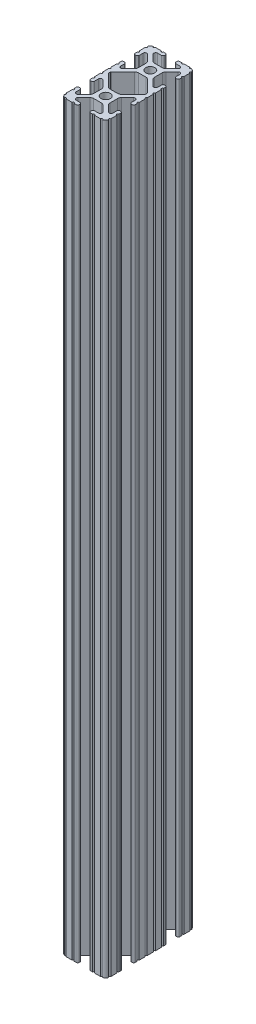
SolidWorks part; units mm, degrees
ref_plane "Front Plane" through (0, 0, 0) normal (0, 0, 1) x (1, 0, 0)
ref_plane "Top Plane" through (0, 0, 0) normal (0, 1, 0) x (1, 0, 0)
ref_plane "Right Plane" through (0, 0, 0) normal (1, 0, 0) x (0, 0, -1)
sketch "Length Definition" plane through (0, 0, 0) normal (0, 0, 1) x (1, 0, 0)
  line L0 (13.97, 0) -> (-13.97, 0) construction
  line L1 (-25.4, 0) -> (25.4, 0) construction
  line L2 (-25.4, 0) -> (-25.4, 268.013) construction
  line L3 (-25.4, 268.013) -> (25.4, 268.013)
  line L4 (25.4, 0) -> (25.4, 268.013) construction
  line L5 (-23.0571, 268.013) -> (-791.1725, 268.013) construction
  point P8 (0, 0)
  dimension "D1" = 50.8
sketch "Upper Arm Sketch" plane through (0, 0, 0) normal (0, 0, 1) x (1, 0, 0)
  line L1 (12.7, 372.2042) -> (280.713, 372.2042) construction
  line L2 (-25.4, 0) -> (25.4, 0) construction
  line L3 (-25.4, 0) -> (-25.4, 423.0042) construction
  line L4 (25.4, 0) -> (25.4, 423.0042) construction
  line L5 (-25.4, 0) -> (25.4, 0) construction
  line L6 (-25.4, 0) -> (-25.4, 268.013) construction
  line L7 (25.4, 0) -> (25.4, 268.013) construction
  line L8 (-25.4, 423.0042) -> (25.4, 423.0042)
  line L9 (0, 423.0042) -> (0, 0)
  dimension "D1" = 50.8
ref_plane "Extrusion End" [suppressed] through (0, 268.013, 0) normal (0, 1, 0) x (1, 0, 0)
sketch "Extrusion profile" [suppressed] plane through (0, 0, 0) normal (0, 0, 1) x (1, 0, 0)
  line L0 (0, 0) -> (0, 268.013)
  line L1 (27.94, 268.013) -> (-27.94, 268.013) construction
  line L2 (-25.4, 268.013) -> (25.4, 268.013) construction
other "Al extrusions 2X1 T-SLOT 1020(1)"
ref_plane "Plane2" through (0, 0, 0) normal (0, 1, 0) x (-1, 0, 0)
sketch "Sketch4" plane through (0, 0, 0) normal (0, 1, 0) x (-1, 0, 0)
  line L0 (0, -25.4) -> (0, 25.4) construction
  line L1 (-12.7, 25.4) -> (12.7, 25.4) construction
  line L2 (-12.7, 25.4) -> (-12.7, -25.4) construction
  line L3 (-12.7, -25.4) -> (12.7, -25.4) construction
  line L4 (12.7, 25.4) -> (12.7, -25.4) construction
  line L5 (12.7, 0) -> (-12.7, 0) construction
  line L6 (-12.7, 25.4) -> (12.7, 0) construction
  line L7 (-12.7, 0) -> (12.7, 25.4) construction
  line L8 (-12.7, 0) -> (12.7, -25.4) construction
  line L9 (12.7, 0) -> (-12.7, -25.4) construction
  line L16 (-2.164, -8.0518) -> (2.164, -8.0518)
  line L17 (-10.3284, -0.809) -> (-3.7373, -7.4001)
  line L18 (-10.4902, 0.4184) -> (-10.4902, -0.4184)
  line L19 (-3.7373, 7.4001) -> (-10.3284, 0.809)
  line L20 (2.164, 8.0518) -> (-2.164, 8.0518)
  line L21 (10.3284, 0.809) -> (3.7373, 7.4001)
  line L22 (10.4902, -0.4184) -> (10.4902, 0.4184)
  line L23 (3.7373, -7.4001) -> (10.3284, -0.809)
  line L152 (-2.164, -17.3482) -> (2.164, -17.3482)
  line L153 (3.7373, -17.9999) -> (7.1039, -21.3665)
  line L154 (6.3485, -23.1902) -> (4.1904, -23.1902)
  line L155 (3.2512, -24.1294) -> (3.2512, -24.4608)
  line L156 (4.1904, -25.4) -> (5.2436, -25.4)
  line L157 (6.3485, -25.4) -> (9.8037, -25.4)
  line L158 (12.7, -22.5037) -> (12.7, -19.0485)
  line L159 (12.7, -17.9436) -> (12.7, -16.8904)
  line L160 (11.7608, -15.9512) -> (11.4294, -15.9512)
  line L161 (10.4902, -16.8904) -> (10.4902, -19.0485)
  line L162 (8.6665, -19.8039) -> (5.2999, -16.4373)
  line L163 (4.6482, -14.864) -> (4.6482, -10.536)
  line L164 (5.2999, -8.9627) -> (8.6665, -5.5961)
  line L165 (10.4902, -6.3515) -> (10.4902, -8.5096)
  line L166 (11.4294, -9.4488) -> (11.7608, -9.4488)
  line L167 (12.7, -8.5096) -> (12.7, -7.4564)
  line L168 (12.7, -6.3515) -> (12.7, -2.8963)
  line L169 (12.7, -1.7914) -> (12.7, 1.7914)
  line L170 (12.7, 2.8963) -> (12.7, 6.3515)
  line L171 (12.7, 7.4564) -> (12.7, 8.5096)
  line L172 (11.7608, 9.4488) -> (11.4294, 9.4488)
  line L173 (10.4902, 8.5096) -> (10.4902, 6.3515)
  line L174 (8.6665, 5.5961) -> (5.2999, 8.9627)
  line L175 (4.6482, 10.536) -> (4.6482, 14.864)
  line L176 (5.2999, 16.4373) -> (8.6665, 19.8039)
  line L177 (10.4902, 19.0485) -> (10.4902, 16.8904)
  line L178 (11.4294, 15.9512) -> (11.7608, 15.9512)
  line L179 (12.7, 16.8904) -> (12.7, 17.9436)
  line L180 (12.7, 19.0485) -> (12.7, 22.5037)
  line L181 (9.8037, 25.4) -> (6.3485, 25.4)
  line L182 (5.2436, 25.4) -> (4.1904, 25.4)
  line L183 (3.2512, 24.4608) -> (3.2512, 24.1294)
  line L184 (4.1904, 23.1902) -> (6.3485, 23.1902)
  line L185 (7.1039, 21.3665) -> (3.7373, 17.9999)
  line L186 (2.164, 17.3482) -> (-2.164, 17.3482)
  line L187 (-3.7373, 17.9999) -> (-7.1039, 21.3665)
  line L188 (-6.3485, 23.1902) -> (-4.1904, 23.1902)
  line L189 (-3.2512, 24.1294) -> (-3.2512, 24.4608)
  line L190 (-4.1904, 25.4) -> (-5.2436, 25.4)
  line L191 (-6.3485, 25.4) -> (-9.8037, 25.4)
  line L192 (-12.7, 22.5037) -> (-12.7, 19.0485)
  line L193 (-12.7, 17.9436) -> (-12.7, 16.8904)
  line L194 (-11.7608, 15.9512) -> (-11.4294, 15.9512)
  line L195 (-10.4902, 16.8904) -> (-10.4902, 19.0485)
  line L196 (-8.6665, 19.8039) -> (-5.2999, 16.4373)
  line L197 (-4.6482, 14.864) -> (-4.6482, 10.536)
  line L198 (-5.2999, 8.9627) -> (-8.6665, 5.5961)
  line L199 (-10.4902, 6.3515) -> (-10.4902, 8.5096)
  line L200 (-11.4294, 9.4488) -> (-11.7608, 9.4488)
  line L201 (-12.7, 8.5096) -> (-12.7, 7.4564)
  line L202 (-12.7, 6.3515) -> (-12.7, 2.8963)
  line L203 (-12.7, 1.7914) -> (-12.7, -1.7914)
  line L204 (-12.7, -2.8963) -> (-12.7, -6.3515)
  line L205 (-12.7, -7.4564) -> (-12.7, -8.5096)
  line L206 (-11.7608, -9.4488) -> (-11.4294, -9.4488)
  line L207 (-10.4902, -8.5096) -> (-10.4902, -6.3515)
  line L208 (-8.6665, -5.5961) -> (-5.2999, -8.9627)
  line L209 (-4.6482, -10.536) -> (-4.6482, -14.864)
  line L210 (-5.2999, -16.4373) -> (-8.6665, -19.8039)
  line L211 (-10.4902, -19.0485) -> (-10.4902, -16.8904)
  line L212 (-11.4294, -15.9512) -> (-11.7608, -15.9512)
  line L213 (-12.7, -16.8904) -> (-12.7, -17.9436)
  line L214 (-12.7, -19.0485) -> (-12.7, -22.5037)
  line L215 (-9.8037, -25.4) -> (-6.3485, -25.4)
  line L216 (-5.2436, -25.4) -> (-4.1904, -25.4)
  line L217 (-3.2512, -24.4608) -> (-3.2512, -24.1294)
  line L218 (-4.1904, -23.1902) -> (-6.3485, -23.1902)
  line L219 (-7.1039, -21.3665) -> (-3.7373, -17.9999)
  circle A2 centre (0, -12.7) radius 2.6035
  circle A4 centre (0, 12.7) radius 2.6035
  arc A16 (-3.7373, -7.4001) -> (-2.164, -8.0518) centre (-2.164, -5.8268) ccw
  arc A17 (-10.4902, -0.4184) -> (-10.3284, -0.809) centre (-9.9377, -0.4184) ccw
  arc A18 (-10.3284, 0.809) -> (-10.4902, 0.4184) centre (-9.9377, 0.4184) ccw
  arc A19 (-2.164, 8.0518) -> (-3.7373, 7.4001) centre (-2.164, 5.8268) ccw
  arc A20 (3.7373, 7.4001) -> (2.164, 8.0518) centre (2.164, 5.8268) ccw
  arc A21 (10.4902, 0.4184) -> (10.3284, 0.809) centre (9.9378, 0.4184) ccw
  arc A22 (10.3284, -0.809) -> (10.4902, -0.4184) centre (9.9378, -0.4184) ccw
  arc A23 (2.164, -8.0518) -> (3.7373, -7.4001) centre (2.164, -5.8268) ccw
  arc A172 (-2.164, -17.3482) -> (-3.7373, -17.9999) centre (-2.164, -19.5732) ccw
  arc A173 (3.7373, -17.9999) -> (2.164, -17.3482) centre (2.164, -19.5732) ccw
  arc A174 (6.3485, -23.1902) -> (7.1039, -21.3665) centre (6.3485, -22.1219) ccw
  arc A175 (4.1904, -23.1902) -> (3.2512, -24.1294) centre (4.1904, -24.1294) ccw
  arc A176 (3.2512, -24.4608) -> (4.1904, -25.4) centre (4.1904, -24.4608) ccw
  arc A177 (6.3485, -25.4) -> (5.2436, -25.4) centre (5.796, -25.4) ccw
  arc A178 (10.8954, -25.28) -> (9.8037, -25.4) centre (10.3562, -25.4) ccw
  arc A179 (10.8954, -25.28) -> (12.58, -23.5954) centre (10.1173, -22.8173) ccw
  arc A180 (12.7, -22.5037) -> (12.58, -23.5954) centre (12.7, -23.0562) ccw
  arc A181 (12.7, -17.9436) -> (12.7, -19.0485) centre (12.7, -18.496) ccw
  arc A182 (12.7, -16.8904) -> (11.7608, -15.9512) centre (11.7608, -16.8904) ccw
  arc A183 (11.4294, -15.9512) -> (10.4902, -16.8904) centre (11.4294, -16.8904) ccw
  arc A184 (8.6665, -19.8039) -> (10.4902, -19.0485) centre (9.4219, -19.0485) ccw
  arc A185 (4.6482, -14.864) -> (5.2999, -16.4373) centre (6.8732, -14.864) ccw
  arc A186 (5.2999, -8.9627) -> (4.6482, -10.536) centre (6.8732, -10.536) ccw
  arc A187 (10.4902, -6.3515) -> (8.6665, -5.5961) centre (9.4219, -6.3515) ccw
  arc A188 (10.4902, -8.5096) -> (11.4294, -9.4488) centre (11.4294, -8.5096) ccw
  arc A189 (11.7608, -9.4488) -> (12.7, -8.5096) centre (11.7608, -8.5096) ccw
  arc A190 (12.7, -6.3515) -> (12.7, -7.4564) centre (12.7, -6.904) ccw
  arc A191 (12.7, -1.7914) -> (12.7, -2.8963) centre (12.7, -2.3438) ccw
  arc A192 (12.7, 2.8963) -> (12.7, 1.7914) centre (12.7, 2.3438) ccw
  arc A193 (12.7, 7.4564) -> (12.7, 6.3515) centre (12.7, 6.904) ccw
  arc A194 (12.7, 8.5096) -> (11.7608, 9.4488) centre (11.7608, 8.5096) ccw
  arc A195 (11.4294, 9.4488) -> (10.4902, 8.5096) centre (11.4294, 8.5096) ccw
  arc A196 (8.6665, 5.5961) -> (10.4902, 6.3515) centre (9.4219, 6.3515) ccw
  arc A197 (4.6482, 10.536) -> (5.2999, 8.9627) centre (6.8732, 10.536) ccw
  arc A198 (5.2999, 16.4373) -> (4.6482, 14.864) centre (6.8732, 14.864) ccw
  arc A199 (10.4902, 19.0485) -> (8.6665, 19.8039) centre (9.4219, 19.0485) ccw
  arc A200 (10.4902, 16.8904) -> (11.4294, 15.9512) centre (11.4294, 16.8904) ccw
  arc A201 (11.7608, 15.9512) -> (12.7, 16.8904) centre (11.7608, 16.8904) ccw
  arc A202 (12.7, 19.0485) -> (12.7, 17.9436) centre (12.7, 18.496) ccw
  arc A203 (12.58, 23.5954) -> (12.7, 22.5037) centre (12.7, 23.0562) ccw
  arc A204 (12.58, 23.5954) -> (10.8954, 25.28) centre (10.1173, 22.8173) ccw
  arc A205 (9.8037, 25.4) -> (10.8954, 25.28) centre (10.3562, 25.4) ccw
  arc A206 (5.2436, 25.4) -> (6.3485, 25.4) centre (5.796, 25.4) ccw
  arc A207 (4.1904, 25.4) -> (3.2512, 24.4608) centre (4.1904, 24.4608) ccw
  arc A208 (3.2512, 24.1294) -> (4.1904, 23.1902) centre (4.1904, 24.1294) ccw
  arc A209 (7.1039, 21.3665) -> (6.3485, 23.1902) centre (6.3485, 22.1219) ccw
  arc A210 (2.164, 17.3482) -> (3.7373, 17.9999) centre (2.164, 19.5732) ccw
  arc A211 (-3.7373, 17.9999) -> (-2.164, 17.3482) centre (-2.164, 19.5732) ccw
  arc A212 (-6.3485, 23.1902) -> (-7.1039, 21.3665) centre (-6.3485, 22.1219) ccw
  arc A213 (-4.1904, 23.1902) -> (-3.2512, 24.1294) centre (-4.1904, 24.1294) ccw
  arc A214 (-3.2512, 24.4608) -> (-4.1904, 25.4) centre (-4.1904, 24.4608) ccw
  arc A215 (-6.3485, 25.4) -> (-5.2436, 25.4) centre (-5.796, 25.4) ccw
  arc A216 (-10.8954, 25.28) -> (-9.8037, 25.4) centre (-10.3562, 25.4) ccw
  arc A217 (-10.8954, 25.28) -> (-12.58, 23.5954) centre (-10.1173, 22.8173) ccw
  arc A218 (-12.7, 22.5037) -> (-12.58, 23.5954) centre (-12.7, 23.0562) ccw
  arc A219 (-12.7, 17.9436) -> (-12.7, 19.0485) centre (-12.7, 18.496) ccw
  arc A220 (-12.7, 16.8904) -> (-11.7608, 15.9512) centre (-11.7608, 16.8904) ccw
  arc A221 (-11.4294, 15.9512) -> (-10.4902, 16.8904) centre (-11.4294, 16.8904) ccw
  arc A222 (-8.6665, 19.8039) -> (-10.4902, 19.0485) centre (-9.4219, 19.0485) ccw
  arc A223 (-4.6482, 14.864) -> (-5.2999, 16.4373) centre (-6.8732, 14.864) ccw
  arc A224 (-5.2999, 8.9627) -> (-4.6482, 10.536) centre (-6.8732, 10.536) ccw
  arc A225 (-10.4902, 6.3515) -> (-8.6665, 5.5961) centre (-9.4219, 6.3515) ccw
  arc A226 (-10.4902, 8.5096) -> (-11.4294, 9.4488) centre (-11.4294, 8.5096) ccw
  arc A227 (-11.7608, 9.4488) -> (-12.7, 8.5096) centre (-11.7608, 8.5096) ccw
  arc A228 (-12.7, 6.3515) -> (-12.7, 7.4564) centre (-12.7, 6.904) ccw
  arc A229 (-12.7, 1.7914) -> (-12.7, 2.8963) centre (-12.7, 2.3438) ccw
  arc A230 (-12.7, -2.8963) -> (-12.7, -1.7914) centre (-12.7, -2.3438) ccw
  arc A231 (-12.7, -7.4564) -> (-12.7, -6.3515) centre (-12.7, -6.904) ccw
  arc A232 (-12.7, -8.5096) -> (-11.7608, -9.4488) centre (-11.7608, -8.5096) ccw
  arc A233 (-11.4294, -9.4488) -> (-10.4902, -8.5096) centre (-11.4294, -8.5096) ccw
  arc A234 (-8.6665, -5.5961) -> (-10.4902, -6.3515) centre (-9.4219, -6.3515) ccw
  arc A235 (-4.6482, -10.536) -> (-5.2999, -8.9627) centre (-6.8732, -10.536) ccw
  arc A236 (-5.2999, -16.4373) -> (-4.6482, -14.864) centre (-6.8732, -14.864) ccw
  arc A237 (-10.4902, -19.0485) -> (-8.6665, -19.8039) centre (-9.4219, -19.0485) ccw
  arc A238 (-10.4902, -16.8904) -> (-11.4294, -15.9512) centre (-11.4294, -16.8904) ccw
  arc A239 (-11.7608, -15.9512) -> (-12.7, -16.8904) centre (-11.7608, -16.8904) ccw
  arc A240 (-12.7, -19.0485) -> (-12.7, -17.9436) centre (-12.7, -18.496) ccw
  arc A241 (-12.58, -23.5954) -> (-12.7, -22.5037) centre (-12.7, -23.0562) ccw
  arc A242 (-12.58, -23.5954) -> (-10.8954, -25.28) centre (-10.1173, -22.8173) ccw
  arc A243 (-9.8037, -25.4) -> (-10.8954, -25.28) centre (-10.3562, -25.4) ccw
  arc A244 (-5.2436, -25.4) -> (-6.3485, -25.4) centre (-5.796, -25.4) ccw
  arc A245 (-4.1904, -25.4) -> (-3.2512, -24.4608) centre (-4.1904, -24.4608) ccw
  arc A246 (-3.2512, -24.1294) -> (-4.1904, -23.1902) centre (-4.1904, -24.1294) ccw
  arc A247 (-7.1039, -21.3665) -> (-6.3485, -23.1902) centre (-6.3485, -22.1219) ccw
  point P45 (0, 25.4)
  point P50 (0, -25.4)
  point P60 (-12.7, 0)
  point P71 (0, 0)
  point P76 (0, 8.0518)
  point P81 (-10.4902, 0)
  point P86 (0, 0)
  dimension "D4" = 5.207
  dimension "D1" = 25.4
  dimension "D2" = 50.8
  dimension "D3" = 25.4
  dimension "D5" = 6.5024
  dimension "D6" = 12.7
  dimension "D7" = 2.2098
  dimension "D8" = 1.1049
  dimension "D9" = 2.164
  dimension "D10" = 0.4184
  dimension "D11" = 5.8268
  dimension "D12" = 9.9377
  dimension "D13" = 135
  dimension "D14" = 45
  dimension "D15" = 8.0518
  dimension "D16" = 10.4902
  dimension "D17" = 8.0518
  dimension "D18" = 10.4902
other "Al extrusions 2X1 T-SLOT 1020(2)"
ref_plane "Plane3" through (0, 423.0042, 0) normal (0, -1, 0) x (1, 0, 0)
sketch "Sketch41" plane through (0, 423.0042, 0) normal (0, -1, 0) x (1, 0, 0)
  line L0 (0, -25.4) -> (0, 25.4) construction
  line L1 (-12.7, 25.4) -> (12.7, 25.4) construction
  line L2 (-12.7, 25.4) -> (-12.7, -25.4) construction
  line L3 (-12.7, -25.4) -> (12.7, -25.4) construction
  line L4 (12.7, 25.4) -> (12.7, -25.4) construction
  line L5 (12.7, 0) -> (-12.7, 0) construction
  line L6 (-12.7, 25.4) -> (12.7, 0) construction
  line L7 (-12.7, 0) -> (12.7, 25.4) construction
  line L8 (-12.7, 0) -> (12.7, -25.4) construction
  line L9 (12.7, 0) -> (-12.7, -25.4) construction
  line L16 (-2.164, -8.0518) -> (2.164, -8.0518)
  line L17 (-10.3284, -0.809) -> (-3.7373, -7.4001)
  line L18 (-10.4902, 0.4184) -> (-10.4902, -0.4184)
  line L19 (-3.7373, 7.4001) -> (-10.3284, 0.809)
  line L20 (2.164, 8.0518) -> (-2.164, 8.0518)
  line L21 (10.3284, 0.809) -> (3.7373, 7.4001)
  line L22 (10.4902, -0.4184) -> (10.4902, 0.4184)
  line L23 (3.7373, -7.4001) -> (10.3284, -0.809)
  line L152 (-2.164, -17.3482) -> (2.164, -17.3482)
  line L153 (3.7373, -17.9999) -> (7.1039, -21.3665)
  line L154 (6.3485, -23.1902) -> (4.1904, -23.1902)
  line L155 (3.2512, -24.1294) -> (3.2512, -24.4608)
  line L156 (4.1904, -25.4) -> (5.2436, -25.4)
  line L157 (6.3485, -25.4) -> (9.8037, -25.4)
  line L158 (12.7, -22.5037) -> (12.7, -19.0485)
  line L159 (12.7, -17.9436) -> (12.7, -16.8904)
  line L160 (11.7608, -15.9512) -> (11.4294, -15.9512)
  line L161 (10.4902, -16.8904) -> (10.4902, -19.0485)
  line L162 (8.6665, -19.8039) -> (5.2999, -16.4373)
  line L163 (4.6482, -14.864) -> (4.6482, -10.536)
  line L164 (5.2999, -8.9627) -> (8.6665, -5.5961)
  line L165 (10.4902, -6.3515) -> (10.4902, -8.5096)
  line L166 (11.4294, -9.4488) -> (11.7608, -9.4488)
  line L167 (12.7, -8.5096) -> (12.7, -7.4564)
  line L168 (12.7, -6.3515) -> (12.7, -2.8963)
  line L169 (12.7, -1.7914) -> (12.7, 1.7914)
  line L170 (12.7, 2.8963) -> (12.7, 6.3515)
  line L171 (12.7, 7.4564) -> (12.7, 8.5096)
  line L172 (11.7608, 9.4488) -> (11.4294, 9.4488)
  line L173 (10.4902, 8.5096) -> (10.4902, 6.3515)
  line L174 (8.6665, 5.5961) -> (5.2999, 8.9627)
  line L175 (4.6482, 10.536) -> (4.6482, 14.864)
  line L176 (5.2999, 16.4373) -> (8.6665, 19.8039)
  line L177 (10.4902, 19.0485) -> (10.4902, 16.8904)
  line L178 (11.4294, 15.9512) -> (11.7608, 15.9512)
  line L179 (12.7, 16.8904) -> (12.7, 17.9436)
  line L180 (12.7, 19.0485) -> (12.7, 22.5037)
  line L181 (9.8037, 25.4) -> (6.3485, 25.4)
  line L182 (5.2436, 25.4) -> (4.1904, 25.4)
  line L183 (3.2512, 24.4608) -> (3.2512, 24.1294)
  line L184 (4.1904, 23.1902) -> (6.3485, 23.1902)
  line L185 (7.1039, 21.3665) -> (3.7373, 17.9999)
  line L186 (2.164, 17.3482) -> (-2.164, 17.3482)
  line L187 (-3.7373, 17.9999) -> (-7.1039, 21.3665)
  line L188 (-6.3485, 23.1902) -> (-4.1904, 23.1902)
  line L189 (-3.2512, 24.1294) -> (-3.2512, 24.4608)
  line L190 (-4.1904, 25.4) -> (-5.2436, 25.4)
  line L191 (-6.3485, 25.4) -> (-9.8037, 25.4)
  line L192 (-12.7, 22.5037) -> (-12.7, 19.0485)
  line L193 (-12.7, 17.9436) -> (-12.7, 16.8904)
  line L194 (-11.7608, 15.9512) -> (-11.4294, 15.9512)
  line L195 (-10.4902, 16.8904) -> (-10.4902, 19.0485)
  line L196 (-8.6665, 19.8039) -> (-5.2999, 16.4373)
  line L197 (-4.6482, 14.864) -> (-4.6482, 10.536)
  line L198 (-5.2999, 8.9627) -> (-8.6665, 5.5961)
  line L199 (-10.4902, 6.3515) -> (-10.4902, 8.5096)
  line L200 (-11.4294, 9.4488) -> (-11.7608, 9.4488)
  line L201 (-12.7, 8.5096) -> (-12.7, 7.4564)
  line L202 (-12.7, 6.3515) -> (-12.7, 2.8963)
  line L203 (-12.7, 1.7914) -> (-12.7, -1.7914)
  line L204 (-12.7, -2.8963) -> (-12.7, -6.3515)
  line L205 (-12.7, -7.4564) -> (-12.7, -8.5096)
  line L206 (-11.7608, -9.4488) -> (-11.4294, -9.4488)
  line L207 (-10.4902, -8.5096) -> (-10.4902, -6.3515)
  line L208 (-8.6665, -5.5961) -> (-5.2999, -8.9627)
  line L209 (-4.6482, -10.536) -> (-4.6482, -14.864)
  line L210 (-5.2999, -16.4373) -> (-8.6665, -19.8039)
  line L211 (-10.4902, -19.0485) -> (-10.4902, -16.8904)
  line L212 (-11.4294, -15.9512) -> (-11.7608, -15.9512)
  line L213 (-12.7, -16.8904) -> (-12.7, -17.9436)
  line L214 (-12.7, -19.0485) -> (-12.7, -22.5037)
  line L215 (-9.8037, -25.4) -> (-6.3485, -25.4)
  line L216 (-5.2436, -25.4) -> (-4.1904, -25.4)
  line L217 (-3.2512, -24.4608) -> (-3.2512, -24.1294)
  line L218 (-4.1904, -23.1902) -> (-6.3485, -23.1902)
  line L219 (-7.1039, -21.3665) -> (-3.7373, -17.9999)
  circle A2 centre (0, -12.7) radius 2.6035
  circle A4 centre (0, 12.7) radius 2.6035
  arc A16 (-3.7373, -7.4001) -> (-2.164, -8.0518) centre (-2.164, -5.8268) ccw
  arc A17 (-10.4902, -0.4184) -> (-10.3284, -0.809) centre (-9.9377, -0.4184) ccw
  arc A18 (-10.3284, 0.809) -> (-10.4902, 0.4184) centre (-9.9377, 0.4184) ccw
  arc A19 (-2.164, 8.0518) -> (-3.7373, 7.4001) centre (-2.164, 5.8268) ccw
  arc A20 (3.7373, 7.4001) -> (2.164, 8.0518) centre (2.164, 5.8268) ccw
  arc A21 (10.4902, 0.4184) -> (10.3284, 0.809) centre (9.9378, 0.4184) ccw
  arc A22 (10.3284, -0.809) -> (10.4902, -0.4184) centre (9.9378, -0.4184) ccw
  arc A23 (2.164, -8.0518) -> (3.7373, -7.4001) centre (2.164, -5.8268) ccw
  arc A172 (-2.164, -17.3482) -> (-3.7373, -17.9999) centre (-2.164, -19.5732) ccw
  arc A173 (3.7373, -17.9999) -> (2.164, -17.3482) centre (2.164, -19.5732) ccw
  arc A174 (6.3485, -23.1902) -> (7.1039, -21.3665) centre (6.3485, -22.1219) ccw
  arc A175 (4.1904, -23.1902) -> (3.2512, -24.1294) centre (4.1904, -24.1294) ccw
  arc A176 (3.2512, -24.4608) -> (4.1904, -25.4) centre (4.1904, -24.4608) ccw
  arc A177 (6.3485, -25.4) -> (5.2436, -25.4) centre (5.796, -25.4) ccw
  arc A178 (10.8954, -25.28) -> (9.8037, -25.4) centre (10.3562, -25.4) ccw
  arc A179 (10.8954, -25.28) -> (12.58, -23.5954) centre (10.1173, -22.8173) ccw
  arc A180 (12.7, -22.5037) -> (12.58, -23.5954) centre (12.7, -23.0562) ccw
  arc A181 (12.7, -17.9436) -> (12.7, -19.0485) centre (12.7, -18.496) ccw
  arc A182 (12.7, -16.8904) -> (11.7608, -15.9512) centre (11.7608, -16.8904) ccw
  arc A183 (11.4294, -15.9512) -> (10.4902, -16.8904) centre (11.4294, -16.8904) ccw
  arc A184 (8.6665, -19.8039) -> (10.4902, -19.0485) centre (9.4219, -19.0485) ccw
  arc A185 (4.6482, -14.864) -> (5.2999, -16.4373) centre (6.8732, -14.864) ccw
  arc A186 (5.2999, -8.9627) -> (4.6482, -10.536) centre (6.8732, -10.536) ccw
  arc A187 (10.4902, -6.3515) -> (8.6665, -5.5961) centre (9.4219, -6.3515) ccw
  arc A188 (10.4902, -8.5096) -> (11.4294, -9.4488) centre (11.4294, -8.5096) ccw
  arc A189 (11.7608, -9.4488) -> (12.7, -8.5096) centre (11.7608, -8.5096) ccw
  arc A190 (12.7, -6.3515) -> (12.7, -7.4564) centre (12.7, -6.904) ccw
  arc A191 (12.7, -1.7914) -> (12.7, -2.8963) centre (12.7, -2.3438) ccw
  arc A192 (12.7, 2.8963) -> (12.7, 1.7914) centre (12.7, 2.3438) ccw
  arc A193 (12.7, 7.4564) -> (12.7, 6.3515) centre (12.7, 6.904) ccw
  arc A194 (12.7, 8.5096) -> (11.7608, 9.4488) centre (11.7608, 8.5096) ccw
  arc A195 (11.4294, 9.4488) -> (10.4902, 8.5096) centre (11.4294, 8.5096) ccw
  arc A196 (8.6665, 5.5961) -> (10.4902, 6.3515) centre (9.4219, 6.3515) ccw
  arc A197 (4.6482, 10.536) -> (5.2999, 8.9627) centre (6.8732, 10.536) ccw
  arc A198 (5.2999, 16.4373) -> (4.6482, 14.864) centre (6.8732, 14.864) ccw
  arc A199 (10.4902, 19.0485) -> (8.6665, 19.8039) centre (9.4219, 19.0485) ccw
  arc A200 (10.4902, 16.8904) -> (11.4294, 15.9512) centre (11.4294, 16.8904) ccw
  arc A201 (11.7608, 15.9512) -> (12.7, 16.8904) centre (11.7608, 16.8904) ccw
  arc A202 (12.7, 19.0485) -> (12.7, 17.9436) centre (12.7, 18.496) ccw
  arc A203 (12.58, 23.5954) -> (12.7, 22.5037) centre (12.7, 23.0562) ccw
  arc A204 (12.58, 23.5954) -> (10.8954, 25.28) centre (10.1173, 22.8173) ccw
  arc A205 (9.8037, 25.4) -> (10.8954, 25.28) centre (10.3562, 25.4) ccw
  arc A206 (5.2436, 25.4) -> (6.3485, 25.4) centre (5.796, 25.4) ccw
  arc A207 (4.1904, 25.4) -> (3.2512, 24.4608) centre (4.1904, 24.4608) ccw
  arc A208 (3.2512, 24.1294) -> (4.1904, 23.1902) centre (4.1904, 24.1294) ccw
  arc A209 (7.1039, 21.3665) -> (6.3485, 23.1902) centre (6.3485, 22.1219) ccw
  arc A210 (2.164, 17.3482) -> (3.7373, 17.9999) centre (2.164, 19.5732) ccw
  arc A211 (-3.7373, 17.9999) -> (-2.164, 17.3482) centre (-2.164, 19.5732) ccw
  arc A212 (-6.3485, 23.1902) -> (-7.1039, 21.3665) centre (-6.3485, 22.1219) ccw
  arc A213 (-4.1904, 23.1902) -> (-3.2512, 24.1294) centre (-4.1904, 24.1294) ccw
  arc A214 (-3.2512, 24.4608) -> (-4.1904, 25.4) centre (-4.1904, 24.4608) ccw
  arc A215 (-6.3485, 25.4) -> (-5.2436, 25.4) centre (-5.796, 25.4) ccw
  arc A216 (-10.8954, 25.28) -> (-9.8037, 25.4) centre (-10.3562, 25.4) ccw
  arc A217 (-10.8954, 25.28) -> (-12.58, 23.5954) centre (-10.1173, 22.8173) ccw
  arc A218 (-12.7, 22.5037) -> (-12.58, 23.5954) centre (-12.7, 23.0562) ccw
  arc A219 (-12.7, 17.9436) -> (-12.7, 19.0485) centre (-12.7, 18.496) ccw
  arc A220 (-12.7, 16.8904) -> (-11.7608, 15.9512) centre (-11.7608, 16.8904) ccw
  arc A221 (-11.4294, 15.9512) -> (-10.4902, 16.8904) centre (-11.4294, 16.8904) ccw
  arc A222 (-8.6665, 19.8039) -> (-10.4902, 19.0485) centre (-9.4219, 19.0485) ccw
  arc A223 (-4.6482, 14.864) -> (-5.2999, 16.4373) centre (-6.8732, 14.864) ccw
  arc A224 (-5.2999, 8.9627) -> (-4.6482, 10.536) centre (-6.8732, 10.536) ccw
  arc A225 (-10.4902, 6.3515) -> (-8.6665, 5.5961) centre (-9.4219, 6.3515) ccw
  arc A226 (-10.4902, 8.5096) -> (-11.4294, 9.4488) centre (-11.4294, 8.5096) ccw
  arc A227 (-11.7608, 9.4488) -> (-12.7, 8.5096) centre (-11.7608, 8.5096) ccw
  arc A228 (-12.7, 6.3515) -> (-12.7, 7.4564) centre (-12.7, 6.904) ccw
  arc A229 (-12.7, 1.7914) -> (-12.7, 2.8963) centre (-12.7, 2.3438) ccw
  arc A230 (-12.7, -2.8963) -> (-12.7, -1.7914) centre (-12.7, -2.3438) ccw
  arc A231 (-12.7, -7.4564) -> (-12.7, -6.3515) centre (-12.7, -6.904) ccw
  arc A232 (-12.7, -8.5096) -> (-11.7608, -9.4488) centre (-11.7608, -8.5096) ccw
  arc A233 (-11.4294, -9.4488) -> (-10.4902, -8.5096) centre (-11.4294, -8.5096) ccw
  arc A234 (-8.6665, -5.5961) -> (-10.4902, -6.3515) centre (-9.4219, -6.3515) ccw
  arc A235 (-4.6482, -10.536) -> (-5.2999, -8.9627) centre (-6.8732, -10.536) ccw
  arc A236 (-5.2999, -16.4373) -> (-4.6482, -14.864) centre (-6.8732, -14.864) ccw
  arc A237 (-10.4902, -19.0485) -> (-8.6665, -19.8039) centre (-9.4219, -19.0485) ccw
  arc A238 (-10.4902, -16.8904) -> (-11.4294, -15.9512) centre (-11.4294, -16.8904) ccw
  arc A239 (-11.7608, -15.9512) -> (-12.7, -16.8904) centre (-11.7608, -16.8904) ccw
  arc A240 (-12.7, -19.0485) -> (-12.7, -17.9436) centre (-12.7, -18.496) ccw
  arc A241 (-12.58, -23.5954) -> (-12.7, -22.5037) centre (-12.7, -23.0562) ccw
  arc A242 (-12.58, -23.5954) -> (-10.8954, -25.28) centre (-10.1173, -22.8173) ccw
  arc A243 (-9.8037, -25.4) -> (-10.8954, -25.28) centre (-10.3562, -25.4) ccw
  arc A244 (-5.2436, -25.4) -> (-6.3485, -25.4) centre (-5.796, -25.4) ccw
  arc A245 (-4.1904, -25.4) -> (-3.2512, -24.4608) centre (-4.1904, -24.4608) ccw
  arc A246 (-3.2512, -24.1294) -> (-4.1904, -23.1902) centre (-4.1904, -24.1294) ccw
  arc A247 (-7.1039, -21.3665) -> (-6.3485, -23.1902) centre (-6.3485, -22.1219) ccw
  point P45 (0, 25.4)
  point P50 (0, -25.4)
  point P60 (-12.7, 0)
  point P71 (0, 0)
  point P76 (0, 8.0518)
  point P81 (-10.4902, 0)
  point P86 (0, 0)
  dimension "D4" = 5.207
  dimension "D1" = 25.4
  dimension "D2" = 50.8
  dimension "D3" = 25.4
  dimension "D5" = 6.5024
  dimension "D6" = 12.7
  dimension "D7" = 2.2098
  dimension "D8" = 1.1049
  dimension "D9" = 2.164
  dimension "D10" = 0.4184
  dimension "D11" = 5.8268
  dimension "D12" = 9.9377
  dimension "D13" = 135
  dimension "D14" = 45
  dimension "D15" = 8.0518
  dimension "D16" = 10.4902
  dimension "D17" = 8.0518
  dimension "D18" = 10.4902
sketch "Sketch42" [suppressed] plane through (0, 0, 0) normal (0, -1, 0) x (1, 0, 0)
  line L1 (2.6035, 12.7) -> (-2.6035, 12.7) construction
  line L2 (0, 15.3035) -> (0, -15.3035) construction
  line L3 (2.6035, -12.7) -> (-2.6035, -12.7) construction
  circle A3 centre (0, 12.7) radius 2.6035 construction
  circle A4 centre (0, -12.7) radius 2.6035 construction
ref_plane "Right T-Slot Align" through (0, 0, -12.7) normal (0, 0, 1) x (1, 0, 0)
ref_plane "Left T-Slot Align" through (0, 0, 12.7) normal (0, 0, 1) x (1, 0, 0)
